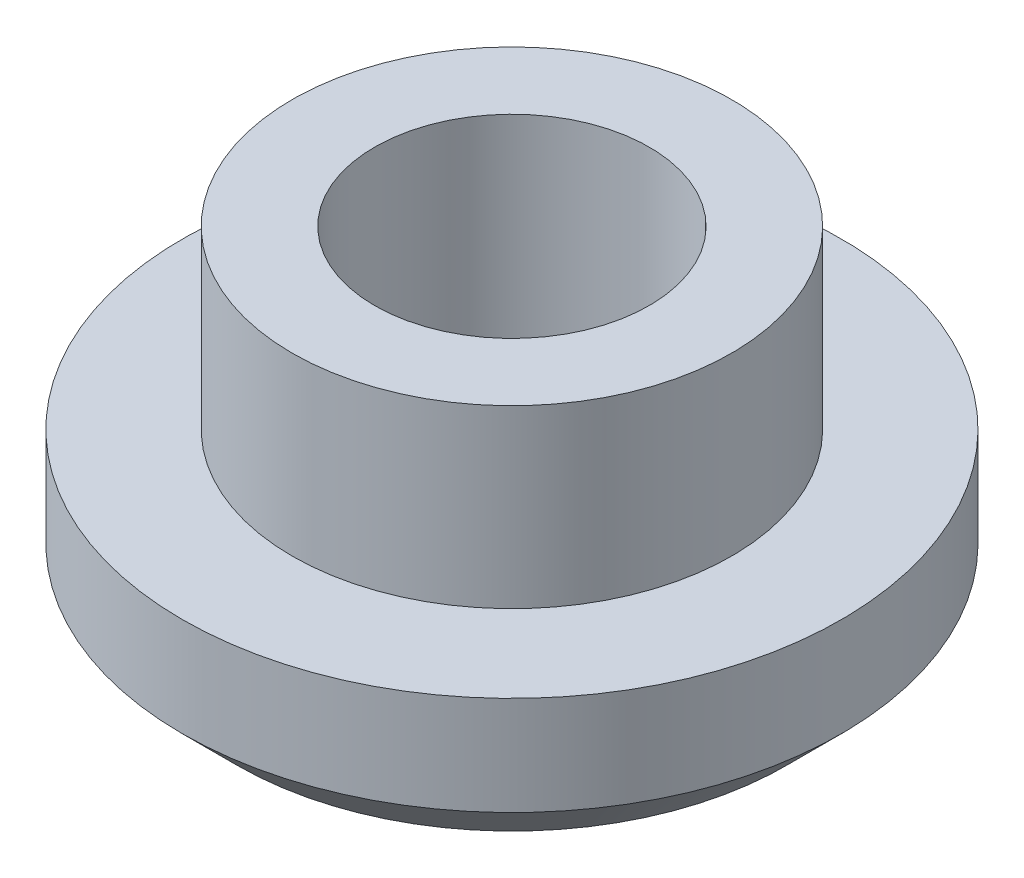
SolidWorks part; units mm, degrees
ref_plane "Front Plane" through (0, 0, 0) normal (0, 0, 1) x (1, 0, 0)
ref_plane "Top Plane" through (0, 0, 0) normal (0, 1, 0) x (1, 0, 0)
ref_plane "Right Plane" through (0, 0, 0) normal (1, 0, 0) x (0, 0, -1)
sketch "Sketch1" plane through (0, 0, 0) normal (0, 1, 0) x (1, 0, 0)
  circle A0 centre (0, 0) radius 6
  dimension "D1" = 12
extrude "Extrude1" add sketch "Sketch1" along normal blind 2.8
chamfer "Chamfer1" distance 1 angle 45 1 edges at (0, 0, 6)
sketch "Sketch2" plane through (0, 2.8, 0) normal (0, 1, 0) x (1, 0, 0)
  circle A0 centre (0, 0) radius 4
  dimension "D1" = 8
extrude "Extrude2" add sketch "Sketch2" along normal blind 3.2
sketch "Sketch3" plane through (0, 6, 0) normal (0, 1, 0) x (1, 0, 0)
  circle A0 centre (0, 0) radius 2.5
  dimension "D1" = 5
extrude "Extrude3" cut sketch "Sketch3" against normal through all
